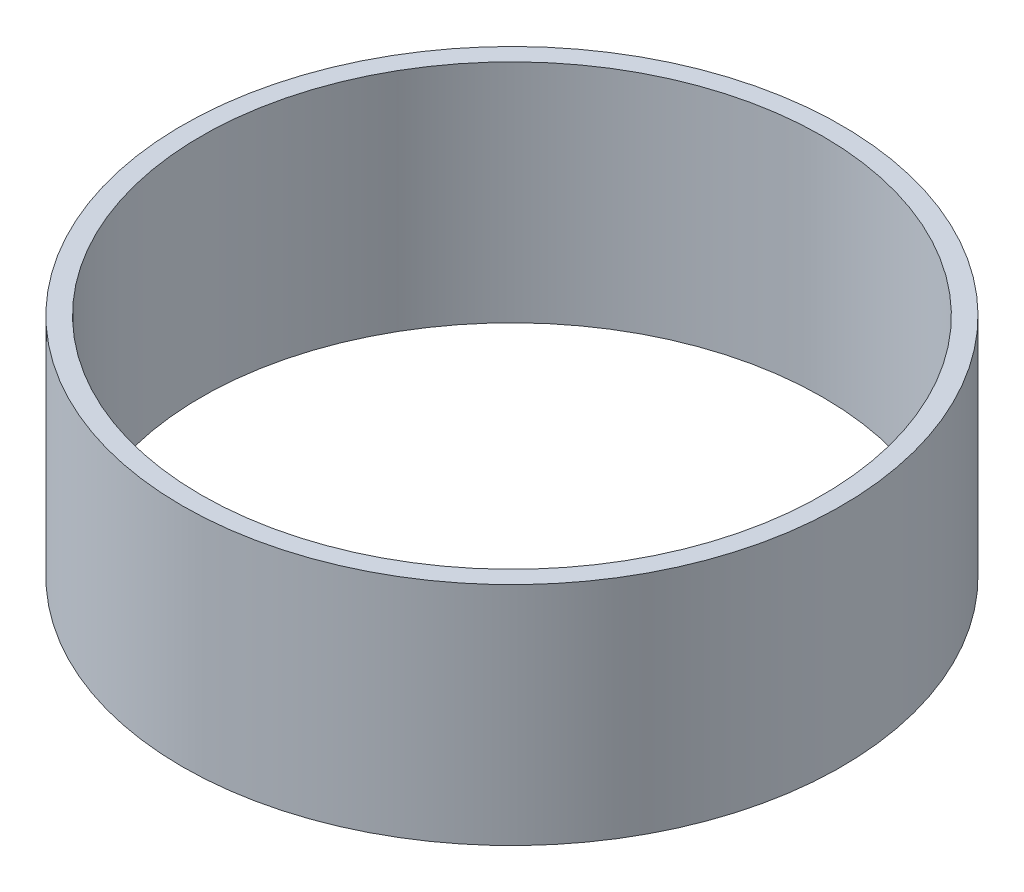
SolidWorks part; units mm, degrees
ref_plane "Front Plane" through (0, 0, 0) normal (0, 0, 1) x (1, 0, 0)
ref_plane "Top Plane" through (0, 0, 0) normal (0, 1, 0) x (1, 0, 0)
ref_plane "Right Plane" through (0, 0, 0) normal (1, 0, 0) x (0, 0, -1)
sketch "Sketch1" plane through (0, 0, 0) normal (0, 1, 0) x (1, 0, 0)
  circle A0 centre (0, 0) radius 17.5
  circle A1 centre (0, 0) radius 16.5
  dimension "D1" = 1
  dimension "D2" = 35
extrude "Boss-Extrude1" add sketch "Sketch1" along normal blind 12
